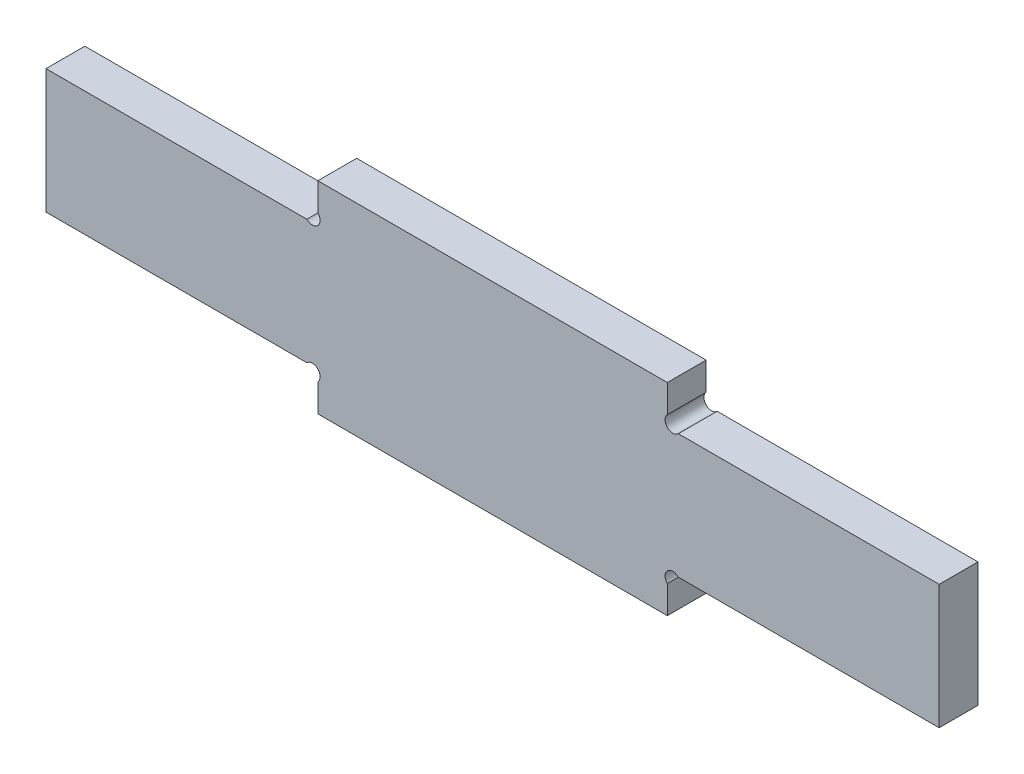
SolidWorks part; units mm, degrees
ref_plane "Plan de face" through (0, 0, 0) normal (0, 0, 1) x (1, 0, 0)
ref_plane "Plan de dessus" through (0, 0, 0) normal (0, 1, 0) x (1, 0, 0)
ref_plane "Plan de droite" through (0, 0, 0) normal (1, 0, 0) x (0, 0, -1)
sketch "Esquisse1" plane through (0, 0, 0) normal (0, 0, 1) x (1, 0, 0)
  line L1 (0, 0) -> (57.5, 0)
  line L2 (0, 0) -> (0, 26)
  line L3 (0, 26) -> (57.5, 26)
  line L4 (57.5, 0) -> (57.5, 26)
  dimension "D1" = 26
  dimension "D2" = 57.5
extrude "Boss.-Extru.1" add sketch "Esquisse1" along normal blind 5
sketch "Esquisse3" plane through (0, 0, 5) normal (0, 0, 1) x (1, 0, 0)
  line L1 (0, 26) -> (35, 26)
  line L2 (0, 26) -> (0, 21)
  line L3 (0, 21) -> (35, 21)
  line L4 (35, 26) -> (35, 21)
  line L5 (0, 0) -> (35, 0)
  line L6 (0, 0) -> (0, 5)
  line L7 (0, 5) -> (35, 5)
  line L8 (35, 0) -> (35, 5)
  dimension "D1" = 5
  dimension "D2" = 5
  dimension "D3" = 35
  dimension "D4" = 35
extrude "Enlèv. mat.-Extru.1" cut sketch "Esquisse3" against normal up to next
sketch "Esquisse4" plane through (0, 0, 5) normal (0, 0, 1) x (1, 0, 0)
  line L0 (35, 21) -> (28.6231, 27.3769) construction
  line L1 (35, 5) -> (29.6888, -0.3112) construction
  line L2 (0, 21) -> (35, 21) construction
  line L3 (35, 5) -> (0, 5) construction
  circle A0 centre (34.2929, 21.7071) radius 1
  circle A1 centre (34.2929, 4.2929) radius 1
  dimension "D3" = 2
  dimension "D4" = 2
  dimension "D1" = 45
  dimension "D2" = 45
extrude "Enlèv. mat.-Extru.2" cut sketch "Esquisse4" against normal up to next
mirror "Symétrie1" about plane through (57.5, 0, 5) normal (-1, 0, 0) of "Enlèv. mat.-Extru.2", "Enlèv. mat.-Extru.1", "Boss.-Extru.1"
